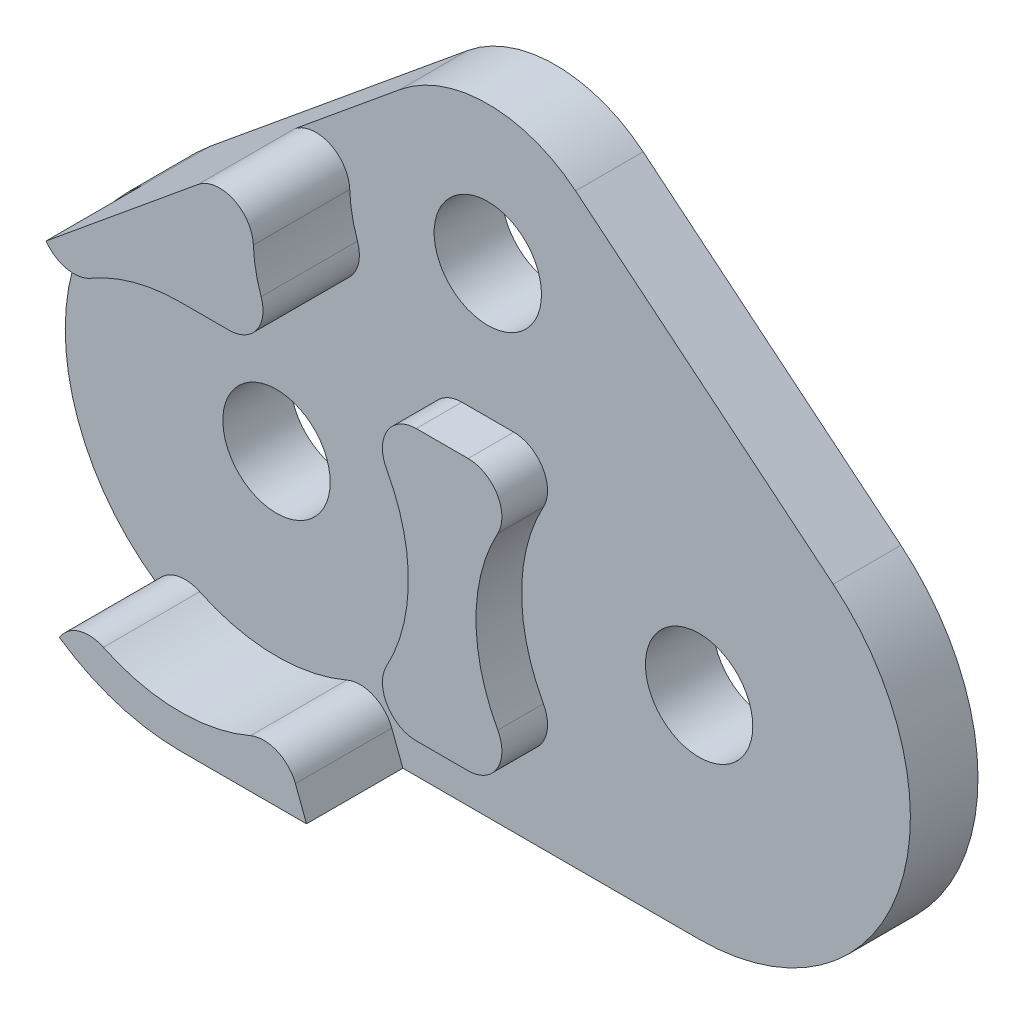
SolidWorks part; units mm, degrees
ref_plane "Front Plane" through (0, 0, 0) normal (0, 0, 1) x (1, 0, 0)
ref_plane "Top Plane" through (0, 0, 0) normal (0, 1, 0) x (1, 0, 0)
ref_plane "Right Plane" through (0, 0, 0) normal (1, 0, 0) x (0, 0, -1)
sketch "Sketch1" plane through (0, 0, 0) normal (0, 0, 1) x (1, 0, 0)
  line L0 (0, 0) -> (0, 6.801) construction
  line L1 (12.5, 0) -> (-12.5, 0) construction
  line L2 (-6.25, 6.25) -> (-6.25, -6.25) construction
  line L3 (-6.25, 6.25) -> (6.25, 6.25)
  line L4 (-6.25, -6.25) -> (6.25, -6.25)
  line L5 (6.25, 6.25) -> (6.25, -6.25) construction
  arc A0 (-6.25, 6.25) -> (-6.25, -6.25) centre (-6.25, 0) ccw
  arc A1 (6.25, 6.25) -> (6.25, -6.25) centre (6.25, 0) cw
  point P9 (0, 6.25)
  point P13 (0, -6.25)
  dimension "D2" = 6.25
  dimension "D1" = 12.5
  dimension "D3" = 6.25
extrude "Base" add sketch "Sketch1" along normal blind 2
sketch "Sketch2" plane through (0, 0, 2) normal (0, 0, 1) x (1, 0, 0)
  line L0 (-12.5, 0) -> (12.5, 0) construction
  line L1 (-6.25, 6.25) -> (-6.25, -6.25) construction
  line L2 (6.25, 6.25) -> (6.25, -6.25) construction
  arc A0 (-6.25, 6.25) -> (-6.25, -6.25) centre (-6.25, 0) ccw construction
  arc A1 (6.25, -6.25) -> (6.25, 6.25) centre (6.25, 0) ccw construction
  circle A2 centre (-6.25, 0) radius 1.5875
  circle A3 centre (6.25, 0) radius 1.5875
  dimension "D1" = 3.175
extrude "Pulley Pins" cut sketch "Sketch2" against normal through all
sketch "Sketch3" plane through (0, 0, 2) normal (0, 0, 1) x (1, 0, 0)
  line L0 (0, 6.25) -> (0, 9.625) construction
  line L1 (6.25, 6.25) -> (-6.25, 6.25) construction
  line L2 (-6.25, 6.25) -> (0, 6.25)
  line L3 (-2.5957, 11.095) -> (-10.219, 4.828)
  line L4 (2.5957, 11.095) -> (10.219, 4.828)
  line L5 (0, 6.25) -> (6.25, 6.25)
  circle A0 centre (0, 7.9375) radius 1.5875
  arc A1 (-2.5957, 11.095) -> (2.5957, 11.095) centre (0, 7.9375) cw
  arc A2 (-6.25, 6.25) -> (-6.25, -6.25) centre (-6.25, 0) ccw construction
  arc A3 (-6.25, 6.25) -> (-10.219, 4.828) centre (-6.25, 0) ccw
  arc A4 (6.25, 6.25) -> (10.219, 4.828) centre (6.25, 0) cw
  dimension "D2" = 3.175
  dimension "D3" = 2.5
  dimension "D1" = 1.6875
extrude "Attachment Pin" add sketch "Sketch3" against normal up to surface (2 mm away) contours A1 L3 L2 A0 L4 M3 M6 M5
sketch "Sketch4" plane through (0, 0, 2) normal (0, 0, 1) x (1, 0, 0)
  line L0 (-6.25, 0) -> (6.25, 0) construction
  line L1 (0, 7.9375) -> (0, 0) construction
  line L2 (-6.25, 0) -> (-6.25, 5.25) construction
  line L3 (-6.25, 0) -> (-6.25, -6.25) construction
  line L4 (-3.25, -4.3084) -> (-2.5127, -6.25)
  line L5 (-6.25, 5.25) -> (-3.0798, 5.25)
  line L6 (-6.25, 0) -> (-9.584, 4.0555) construction
  line L7 (-9.584, 4.0555) -> (-10.219, 4.828)
  line L8 (-6.25, -6.25) -> (6.25, -6.25) construction
  line L11 (-2.5127, -6.25) -> (-6.25, -6.25)
  line L12 (-6.25, 0) -> (-9.25, -4.3084) construction
  line L13 (-9.25, -4.3084) -> (-9.8214, -5.1291)
  line L14 (-10.219, 4.828) -> (-2.5957, 11.095)
  arc A0 (-6.25, 5.25) -> (-9.584, 4.0555) centre (-6.25, 0) ccw
  circle A4 centre (-6.25, 0) radius 5.25 construction
  arc A5 (-10.219, 4.828) -> (-6.25, -6.25) centre (-6.25, 0) ccw construction
  arc A6 (-3.25, -4.3084) -> (-9.25, -4.3084) centre (-6.25, 0) cw
  arc A7 (-9.8214, -5.1291) -> (-6.25, -6.25) centre (-6.25, 0) ccw
  circle A8 centre (0, 7.9375) radius 4.0875 construction
  arc A10 (-3.0798, 5.25) -> (-2.5957, 11.095) centre (0, 7.9375) cw
  dimension "D1" = 10.5
  dimension "D2" = 3
extrude "Side Extrudes" add sketch "Sketch4" along normal blind 2.85
sketch "Sketch5" plane through (0, 0, 2) normal (0, 0, 1) x (1, 0, 0)
  line L0 (-2.8496, 4) -> (2.8496, 4)
  line L1 (0, 5.6144) -> (0, 0) construction
  line L2 (0, 0) -> (12.5, 0) construction
  line L3 (-2.8496, -4) -> (2.8496, -4)
  arc A0 (-2.8496, 4) -> (-2.8496, -4) centre (-6.25, 0) cw
  arc A1 (2.8496, 4) -> (2.8496, -4) centre (6.25, 0) ccw
  circle A4 centre (-6.25, 0) radius 5.25 construction
  arc A5 (-9.25, -4.3084) -> (-3.25, -4.3084) centre (-6.25, 0) ccw construction
  arc A6 (6.25, -6.25) -> (10.219, 4.828) centre (6.25, 0) ccw construction
  point P3 (0, 4)
  point P15 (0, -4)
  dimension "D1" = 4
extrude "Center Extrude" add sketch "Sketch5" along normal blind 1.35
fillet "Contouring" radius 1 9 edges at (-9.25, -4.3084, 3.425) (-9.584, 4.0555, 3.425) (-3.0798, 5.25, 3.425) (-2.5957, 11.095, 3.425) (-2.8496, -4, 2.675) (2.8496, -4, 2.675) (2.8496, 4, 2.675) (-2.8496, 4, 2.675) (-3.25, -4.3084, 3.425)
ref_point "Ref Center"
equation "\"D1@Sketch4\" = \"pulley diameter@values@params.sldprt\" + 1"
equation "\"D1@Side Extrudes\"=\"pulley thickness@values@params.sldprt\"+\"print free@values@params.sldprt\""
equation "\"D1@Center Extrude\"=(\"pulley thickness@values@params.sldprt\"+0.3)/2"
equation "\"D1@Sketch1\"=\"pulley diameter@values@params.sldprt\"+3"
equation "\"D2@Sketch1\"=\"pulley diameter@values@params.sldprt\"/2+1.5"
equation "\"D3@Sketch1\"= \"pulley diameter@values@params.sldprt\"/2+1.5"
equation "\"D2@Sketch3\"=\"pin diameter@values@params.sldprt\""
equation "\"D1@Sketch3\"=\"pin diameter@values@params.sldprt\"/2+0.1"
equation "\"D1@Sketch2\"=\"pin diameter@values@params.sldprt\""
